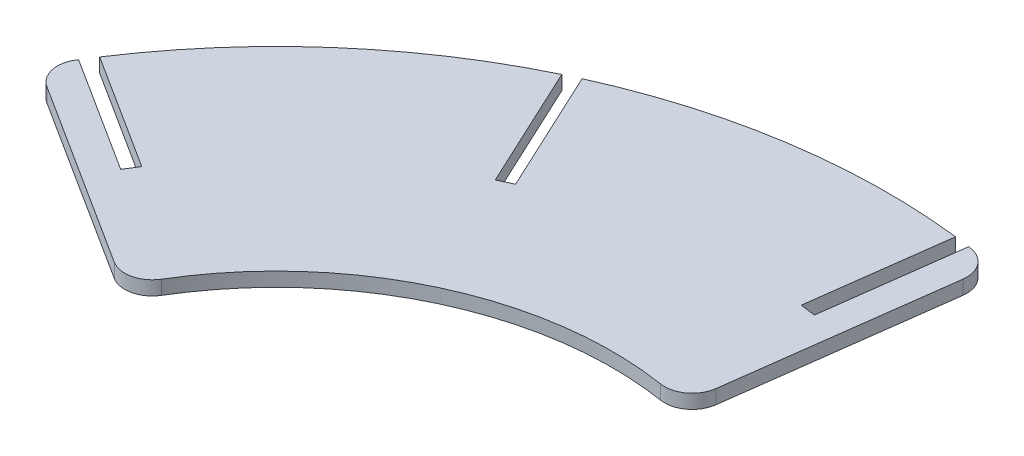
SolidWorks part; units mm, degrees
ref_plane "Alzado" through (0, 0, 0) normal (0, 0, 1) x (1, 0, 0)
ref_plane "Planta" through (0, 0, 0) normal (0, 1, 0) x (1, 0, 0)
ref_plane "Vista lateral" through (0, 0, 0) normal (1, 0, 0) x (0, 0, -1)
sketch "Croquis3" plane through (0, 0, 0) normal (0, 1, 0) x (1, 0, 0)
  line L0 (-680.8913, -14.8372) -> (-680.9064, -14.8275)
  line L1 (66.0033, 345.8759) -> (90.7895, 342.6127)
  line L2 (-357.9558, 274.6969) -> (-357.9633, 274.7132)
  line L3 (-338.9145, 283.5531) -> (-361.5722, 272.9876)
  line L4 (69.9718, 345.3744) -> (69.9742, 345.3922)
  line L5 (-669.5904, 2.8629) -> (-683.0229, -18.2219)
  line L7 (-671.7572, -0.4995) -> (-671.7723, -0.4899)
  line L9 (-342.5485, 281.8815) -> (-342.5561, 281.8977)
  line L11 (86.8264, 343.1555) -> (86.8287, 343.1732)
  line L13 (68.4847, 345.5702) -> (97.8615, 568.7093) construction
  line L14 (69.9718, 345.3744) -> (99.3486, 568.5135) construction
  line L15 (-860.7265, 121.6658) -> (-860.7687, 121.6927)
  line L16 (-436.2843, 486.4478) -> (-436.3055, 486.4931)
  line L17 (117.6838, 566.0492) -> (117.6904, 566.0987)
  line L18 (86.8264, 343.1555) -> (116.2032, 566.2945) construction
  line L19 (-871.4725, 104.798) -> (-871.5147, 104.8248)
  line L20 (-454.4105, 477.9954) -> (-454.4316, 478.0407)
  line L21 (97.8549, 568.6597) -> (97.8615, 568.7093)
  line L22 (108.0974, 110.1678) -> (167.2626, 559.5724)
  line L23 (88.3136, 342.9597) -> (117.6904, 566.0987) construction
  line L24 (-359.3152, 274.063) -> (-454.4316, 478.0407) construction
  line L25 (-516.0851, -180.8933) -> (-898.3797, 62.6553)
  line L26 (-708.5622, -58.2718) -> (-898.3797, 62.6553) construction
  line L27 (-357.9558, 274.6969) -> (-453.0721, 478.6747) construction
  line L28 (137.8858, 336.4334) -> (167.2626, 559.5724) construction
  line L29 (-342.5485, 281.8815) -> (-437.6649, 485.8592) construction
  line L30 (-341.1891, 282.5154) -> (-436.3055, 486.4931) construction
  line L31 (-681.6972, -16.1022) -> (-871.5147, 104.8248) construction
  line L32 (-680.8913, -14.8372) -> (-870.7088, 106.0899) construction
  line L33 (-671.7572, -0.4995) -> (-861.5747, 120.4276) construction
  line L34 (-670.9512, 0.7656) -> (-860.7687, 121.6927) construction
  line L40 (-669.5904, 2.8629) -> (-859.4255, 123.8011)
  line L41 (-338.9145, 283.5531) -> (-434.0397, 487.5497)
  line L42 (90.7895, 342.6127) -> (120.169, 565.7724)
  line L43 (66.0033, 345.8759) -> (95.3829, 569.0356)
  line L44 (-361.5722, 272.9876) -> (-456.6974, 476.9842)
  line L45 (-683.0229, -18.2219) -> (-872.858, 102.7164)
  arc A0 (167.0275, 557.7862) -> (117.6838, 566.0492) centre (-22.7503, -424.0409) ccw
  arc A1 (108.0974, 110.1678) -> (-516.0851, -180.8933) centre (-22.7503, -424.0409) ccw
  arc A6 (97.8549, 568.6597) -> (-436.2843, 486.4478) centre (-22.7503, -424.0409) ccw
  arc A8 (-454.4105, 477.9954) -> (-860.7265, 121.6658) centre (-22.7503, -424.0409) ccw
  arc A9 (-871.4725, 104.798) -> (-896.8602, 61.6873) centre (-22.7503, -424.0409) ccw
  dimension "D5" = 50
  dimension "D1" = 1.5
  dimension "D2" = 1.5
  dimension "D3" = 50
extrude "Saliente-Extruir1" add sketch "Croquis3" along normal blind 23
fillet "Redondeo1" radius 45 1 edges at (167.0275, 11.5, -557.7862)
fillet "Redondeo2" radius 45 1 edges at (108.0974, 11.5, -110.1678)
fillet "Redondeo3" radius 45 2 edges at (-516.0851, 11.5, 180.8933) (-896.8602, 11.5, -61.6873)
